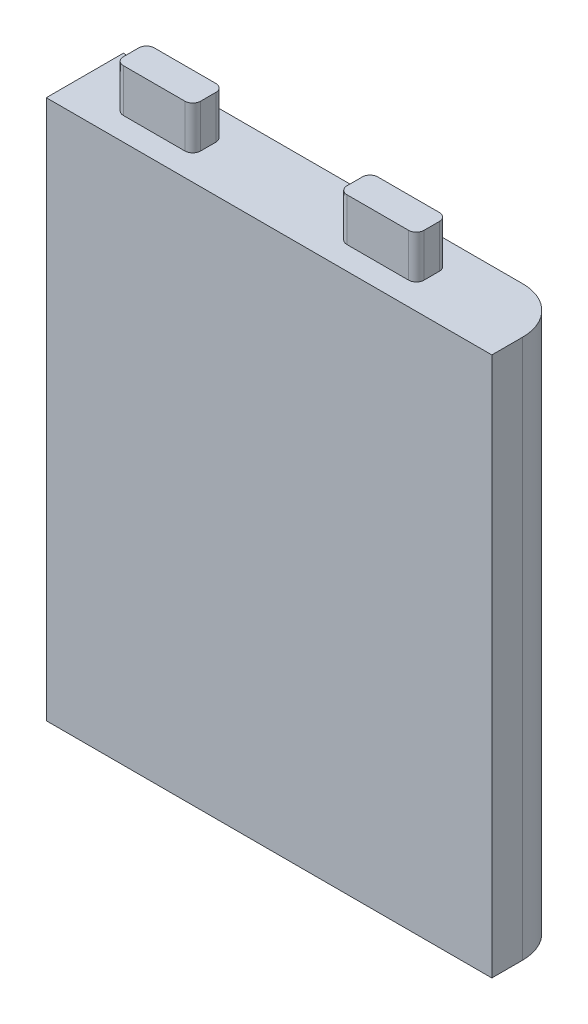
SolidWorks part; units mm, degrees
ref_plane "前视基准面" through (0, 0, 0) normal (0, 0, 1) x (1, 0, 0)
ref_plane "上视基准面" through (0, 0, 0) normal (0, 1, 0) x (1, 0, 0)
ref_plane "右视基准面" through (0, 0, 0) normal (1, 0, 0) x (0, 0, -1)
sketch "草图1" plane through (0, 0, 0) normal (0, 0, 1) x (1, 0, 0)
  line L1 (0, 0) -> (28.9, 0)
  line L2 (0, 0) -> (0, 35)
  line L3 (0, 35) -> (28.9, 35)
  line L4 (28.9, 0) -> (28.9, 35)
  dimension "D1" = 28.9
  dimension "D2" = 35
extrude "凸台-拉伸1" add sketch "草图1" along normal blind 5
fillet "圆角1" radius 3 1 edges at (28.9, 17.5, 0)
sketch "草图3" plane through (0, 35, 0) normal (0, -1, 0) x (1, 0, 0)
  line L0 (0, 5) -> (28.9, 5) construction
  line L1 (3.5, 3.5) -> (7.5, 3.5)
  line L2 (3, 3) -> (3, 2)
  line L3 (3.5, 1.5) -> (7.5, 1.5)
  line L4 (8, 3) -> (8, 2)
  line L5 (0, 5) -> (0, 0) construction
  arc A0 (7.5, 3.5) -> (8, 3) centre (7.5, 3) cw
  arc A1 (7.5, 1.5) -> (8, 2) centre (7.5, 2) ccw
  arc A2 (3, 2) -> (3.5, 1.5) centre (3.5, 2) ccw
  arc A3 (3.5, 3.5) -> (3, 3) centre (3.5, 3) ccw
  point P10 (8, 3.5)
  point P13 (8, 1.5)
  point P18 (3, 3.5)
  dimension "D5" = 0.5
  dimension "D1" = 1.5
  dimension "D2" = 3
  dimension "D3" = 5
  dimension "D4" = 2
extrude "凸台-拉伸3" add sketch "草图3" against normal blind 2.8
sketch "草图4" plane through (0, 0, 0) normal (0, -1, 0) x (1, 0, 0)
  line L0 (0, 5) -> (0, 0) construction
  line L1 (3.5, 3.5) -> (7.5, 3.5)
  line L2 (3, 3) -> (3, 2)
  line L3 (3.5, 1.5) -> (7.5, 1.5)
  line L4 (8, 3) -> (8, 2)
  line L5 (0, 5) -> (28.9, 5) construction
  arc A0 (7.5, 1.5) -> (8, 2) centre (7.5, 2) ccw
  arc A1 (7.5, 3.5) -> (8, 3) centre (7.5, 3) cw
  arc A2 (3, 2) -> (3.5, 1.5) centre (3.5, 2) ccw
  arc A3 (3.5, 3.5) -> (3, 3) centre (3.5, 3) ccw
  point P10 (8, 1.5)
  point P13 (8, 3.5)
  point P18 (3, 3.5)
  dimension "D5" = 0.5
  dimension "D1" = 3
  dimension "D2" = 5
  dimension "D3" = 1.5
  dimension "D4" = 2
extrude "切除-拉伸1" cut sketch "草图4" against normal blind 3
pattern_linear "阵列(线性)1" count 2 spacing 14.5 along (1, 0, 0) of "凸台-拉伸3"
chamfer "倒角1" distance 0.5 angle 45 8 edges at (3.1464, 0, 1.6464) (3, 0, 2.5) (3.1464, 0, 3.3536) (5.5, 0, 3.5) (7.8536, 0, 3.3536) (5.5, 0, 1.5) (7.8536, 0, 1.6464) (8, 0, 2.5)
sketch "草图2" plane through (0, 35, 0) normal (0, 1, 0) x (1, 0, 0)
  line L0 (28.9, -5) -> (0, -5) construction
  circle A0 centre (26.4, -5) radius 0.95
  dimension "D1" = 1.9
  dimension "D2" = 2.5
extrude "凸台-拉伸2" add sketch "草图2" against normal up to surface (35 mm away)
